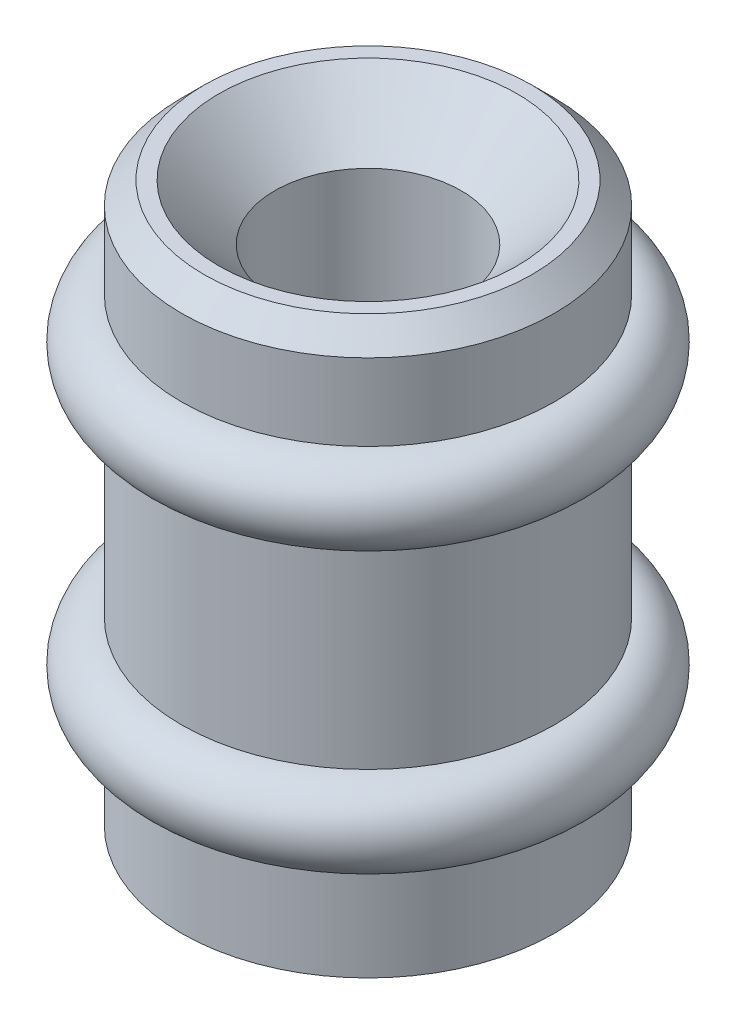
SolidWorks part; units mm, degrees
ref_plane "Front Plane" through (0, 0, 0) normal (0, 0, 1) x (1, 0, 0)
ref_plane "Top Plane" through (0, 0, 0) normal (0, 1, 0) x (1, 0, 0)
ref_plane "Right Plane" through (0, 0, 0) normal (1, 0, 0) x (0, 0, -1)
sketch "Sketch1" plane through (0, 0, 0) normal (0, 1, 0) x (1, 0, 0)
  circle A0 centre (0, 0) radius 3.175
  dimension "D1" = 6.35
extrude "Boss-Extrude1" add sketch "Sketch1" along normal blind 9.525
sketch "Sketch2" plane through (0, 0, 0) normal (0, 0, 1) x (1, 0, 0)
  line L0 (3.175, 9.525) -> (-3.175, 9.525) construction
  line L1 (3.175, 9.525) -> (-3.175, 9.525)
  line L2 (-3.175, 9.525) -> (-3.175, 0)
  line L3 (-3.175, 0) -> (3.175, 0) construction
  line L4 (0, 0) -> (0, 12.7) construction
  circle A0 centre (-3.175, 7.1437) radius 0.7938 construction
  circle A1 centre (-3.175, 2.3813) radius 0.7938 construction
  circle A2 centre (-3.175, 7.1437) radius 0.6937
  circle A3 centre (-3.175, 2.3813) radius 0.6937
  dimension "D1" = 1.5875
  dimension "D2" = 2.3813
  dimension "D3" = 2.3813
  dimension "D4" = 0.1
revolve "Revolve1" add sketch "Sketch2" angle 360 about L4
sketch "Sketch3" plane through (0, 9.525, 0) normal (0, 1, 0) x (1, 0, 0)
  circle A0 centre (0, 0) radius 1.5875
  dimension "D1" = 3.175
extrude "Cut-Extrude1" cut sketch "Sketch3" against normal blind 12.7
chamfer "Chamfer1" distance 0.9525 angle 45 1 edges at (0, 9.525, 1.5875)
chamfer "Chamfer3" distance 0.381 angle 45 1 edges at (0, 9.525, 3.175)
